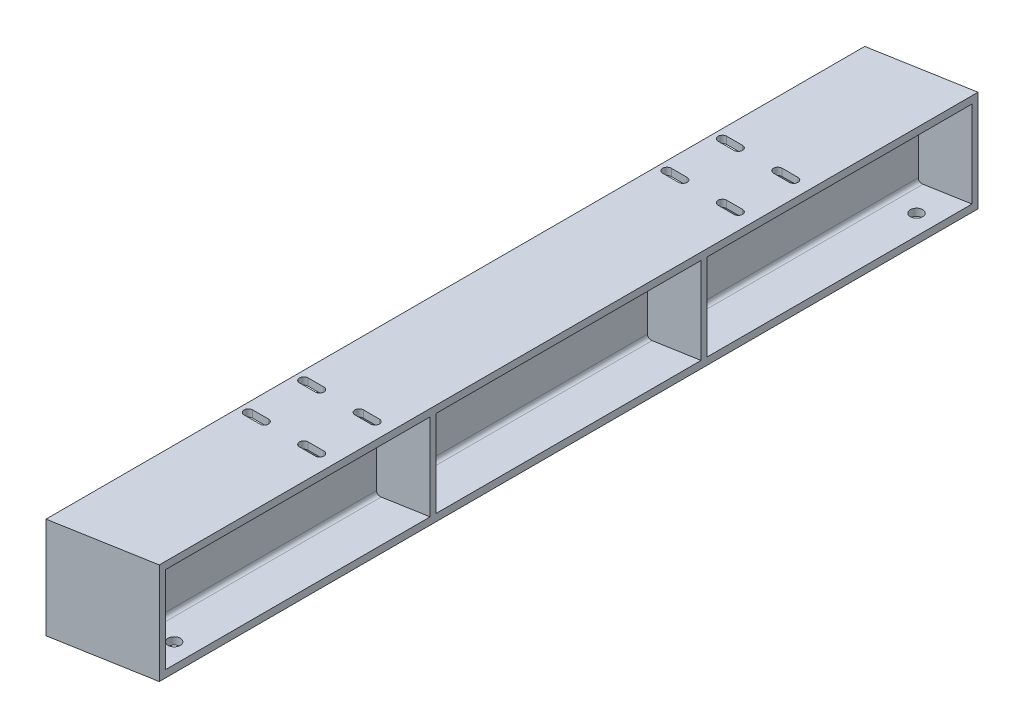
SolidWorks part; units mm, degrees
ref_plane "Plane1" through (0, 0, 0) normal (0, 0, 1) x (1, 0, 0)
ref_plane "Plane2" through (0, 0, 0) normal (0, 1, 0) x (1, 0, 0)
ref_plane "Plane3" through (0, 0, 0) normal (1, 0, 0) x (0, 0, -1)
sketch "Sketch1" plane through (0, 0, 0) normal (0, 0, 1) x (1, 0, 0)
  line L0 (0, 0) -> (0, 11.557)
  line L1 (0, 11.557) -> (66.802, 11.557)
  line L2 (73.152, 17.907) -> (73.152, 144.145)
  line L3 (66.802, 150.495) -> (0, 150.495)
  line L4 (0, 150.495) -> (0, 162.052)
  line L5 (0, 162.052) -> (154.432, 162.052)
  line L6 (154.432, 162.052) -> (154.432, 150.495)
  line L7 (154.432, 150.495) -> (87.63, 150.495)
  line L8 (81.28, 144.145) -> (81.28, 17.907)
  line L9 (87.63, 11.557) -> (154.432, 11.557)
  line L10 (154.432, 11.557) -> (154.432, 0)
  line L11 (154.432, 0) -> (0, 0)
  line L12 (77.216, -72.1361) -> (77.216, 162.052) construction
  arc A0 (66.802, 11.557) -> (73.152, 17.907) centre (66.802, 17.907) ccw
  arc A1 (73.152, 144.145) -> (66.802, 150.495) centre (66.802, 144.145) ccw
  arc A2 (87.63, 150.495) -> (81.28, 144.145) centre (87.63, 144.145) ccw
  arc A3 (81.28, 17.907) -> (87.63, 11.557) centre (87.63, 17.907) ccw
extrude "BaseSteelW" add sketch "Sketch1" against normal mid plane 1340.358
sketch "Sketch2" plane through (0, 162.052, 0) normal (0, 1, 0) x (1, 0, 0)
  line L0 (0, 670.179) -> (154.432, 670.179)
  line L1 (154.432, 670.179) -> (0, 642.9504)
  line L2 (0, 670.179) -> (0, -670.179) construction
  line L3 (0, 642.9504) -> (0, 670.179)
  line L4 (154.432, -670.179) -> (0, -670.179)
  line L5 (154.432, -670.179) -> (154.432, -642.9504)
  line L6 (154.432, 670.179) -> (154.432, -670.179) construction
  line L7 (154.432, -642.9504) -> (0, -670.179)
  dimension "D1" = 80.001
  dimension "D2" = 80.001
extrude "Cut-Extrude1" cut sketch "Sketch2" against normal through all
ref_plane "Plane4" through (77.216, 0, 0) normal (1, 0, 0) x (0, 0, -1)
sketch "Sketch6" plane through (0, 162.052, 0) normal (0, 1, 0) x (1, 0, 0)
  line L0 (0, 642.9504) -> (154.432, 670.179)
  line L1 (154.432, 670.179) -> (154.432, 660.5071)
  line L2 (154.432, 670.179) -> (154.432, -642.9504) construction
  line L3 (154.432, 660.5071) -> (0, 633.2785)
  line L4 (0, 642.9504) -> (0, -670.179) construction
  line L5 (0, 633.2785) -> (0, 642.9504)
  dimension "D1" = 9.525
extrude "Boss-Extrude2" add sketch "Sketch6" against normal up to surface (162.052 mm away)
pattern_linear "LPattern2" count 4 spacing 434.5051 along (0.1736, 0, 0.9848) of "Boss-Extrude2"
hole_wizard "3/4 Clearance Hole1" positions "Sketch4" profile "Sketch3" hole size "3/4" standard "Ansi Inch"
sketch "Sketch4" plane through (0, 11.557, 0) normal (0, 1, 0) x (-1, 0, 0)
  line L0 (0, -633.2785) -> (-66.802, -645.0567) construction
  line L1 (-66.802, 648.7867) -> (0, 660.5649) construction
  line L2 (-87.63, -648.7289) -> (-154.432, -660.5071) construction
  line L3 (-154.432, 633.3363) -> (-87.63, 645.1145) construction
  line L4 (-154.432, 208.5031) -> (-154.432, 633.3363) construction
  line L5 (-154.432, -660.5071) -> (-154.432, -235.6739) construction
  line L6 (0, -633.2785) -> (0, -208.4453) construction
  line L7 (0, 235.7317) -> (0, 660.5649) construction
  point P0 (-31.75, -587.2929)
  point P2 (-31.75, 603.3833)
  point P4 (-122.682, 587.3507)
  point P6 (-122.682, -603.3255)
  dimension "D1" = 50.8
  dimension "D2" = 50.8
  dimension "D3" = 50.8
  dimension "D4" = 50.8
  dimension "D5" = 31.75
  dimension "D6" = 31.75
  dimension "D7" = 31.75
  dimension "D8" = 31.75
sketch "Sketch3" plane through (31.75, 11.557, -587.2929) normal (1, 0, 0) x (0, 0, 1)
  line L0 (0, 0) -> (0, 11.557)
  line L1 (0, 11.557) -> (9.9212, 11.557)
  line L2 (9.9212, 11.557) -> (9.9212, 0)
  line L5 (9.9212, 0) -> (0, 0)
  line L11 (0, -6.35) -> (0, 107.95) construction
  dimension "Thru Hole Dia." = 19.8425
  dimension "Thru Hole Depth" = 11.557
sketch "No Paint Zone, Bottom" plane through (0, 0, 0) normal (0, -1, 0) x (1, 0, 0)
  line L1 (0, -511.3014) -> (154.432, -670.179) construction
  line L3 (0, -642.9504) -> (154.432, -538.5582) construction
  line L4 (0, -511.3014) -> (154.432, -538.5582)
  line L5 (0, -642.9504) -> (0, 670.2368) construction
  line L6 (154.432, -670.179) -> (154.432, 643.0082) construction
  line L7 (0, 537.9694) -> (154.432, 510.7127)
  line L8 (0, 670.2368) -> (154.432, 510.7127) construction
  line L9 (154.432, 643.0082) -> (0, 537.9694) construction
sketch "No Paint Zone, Around Bolt Holes" plane through (0, 11.557, 0) normal (0, 1, 0) x (1, 0, 0)
  circle A0 centre (31.75, 587.2929) radius 19.05
  circle A1 centre (31.75, -603.3833) radius 19.05
  circle A2 centre (122.682, -587.3507) radius 19.05
  circle A3 centre (122.682, 603.3255) radius 19.05
  dimension "D1" = 38.1
sketch "No Paint Zone, Top" plane through (0, 162.052, 0) normal (0, 1, 0) x (1, 0, 0)
  line L1 (27.3305, 258.9253) -> (0, 363.3365)
  line L3 (0, 642.9504) -> (0, -670.2368) construction
  line L5 (0, 363.3365) -> (0, 396.1779)
  line L7 (23.2357, -261.2271) -> (131.1868, -134.228) construction
  line L9 (23.2368, -134.2271) -> (131.1857, -261.228) construction
  line L11 (27.3305, 258.9253) -> (127.1015, 429.4478) construction
  line L12 (0, 396.1779) -> (127.1015, 429.4478)
  line L13 (23.2357, -261.2271) -> (23.2368, -134.2271)
  line L14 (23.2368, -134.2271) -> (131.1868, -134.228)
  line L15 (131.1868, -134.228) -> (131.1857, -261.228)
  line L16 (131.1857, -261.228) -> (23.2357, -261.2271)
  line L17 (0, 396.1779) -> (154.432, 325.0366) construction
  line L22 (127.1015, 429.4478) -> (154.432, 325.0366)
  line L23 (154.432, 670.179) -> (154.432, -643.0082) construction
  line L24 (154.432, 325.0366) -> (154.432, 292.1952)
  line L25 (154.432, 292.1952) -> (27.3305, 258.9253)
ref_point "Point1"
sketch "Sketch7" plane through (0, 162.052, 0) normal (0, 1, 0) x (1, 0, 0)
  line L0 (-3088.7228, -17.4888) -> (-1221.7255, -17.5051) construction
  line L1 (-95.8438, -17.5149) -> (232.2311, -17.5177) construction
  line L2 (39.4436, -359.7058) -> (14.0436, -359.7056) construction
  line L3 (39.4435, -366.6527) -> (14.0435, -366.6525)
  line L4 (39.4436, -352.7589) -> (14.0436, -352.7587)
  line L5 (39.4444, -270.8058) -> (14.0444, -270.8056) construction
  line L6 (39.4443, -277.7527) -> (14.0443, -277.7525)
  line L7 (39.4444, -263.8589) -> (14.0444, -263.8587)
  line L8 (128.3436, -359.7066) -> (102.9436, -359.7063) construction
  line L9 (128.3435, -366.6535) -> (102.9435, -366.6532)
  line L10 (128.3436, -352.7597) -> (102.9436, -352.7594)
  line L11 (128.3444, -270.8066) -> (102.9444, -270.8063) construction
  line L12 (128.3443, -277.7535) -> (102.9443, -277.7532)
  line L13 (128.3444, -263.8597) -> (102.9444, -263.8594)
  line L14 (39.4494, 311.6822) -> (14.0494, 311.6825) construction
  line L15 (39.4494, 304.7353) -> (14.0494, 304.7356)
  line L16 (39.4495, 318.6291) -> (14.0495, 318.6294)
  line L17 (39.4502, 400.5822) -> (14.0502, 400.5825) construction
  line L18 (39.4502, 393.6353) -> (14.0502, 393.6356)
  line L19 (39.4503, 407.5291) -> (14.0503, 407.5294)
  line L20 (128.3494, 311.6815) -> (102.9494, 311.6817) construction
  line L21 (128.3494, 304.7346) -> (102.9494, 304.7348)
  line L22 (128.3495, 318.6284) -> (102.9495, 318.6286)
  line L23 (128.3502, 400.5815) -> (102.9502, 400.5817) construction
  line L24 (128.3502, 393.6346) -> (102.9502, 393.6348)
  line L25 (128.3503, 407.5284) -> (102.9503, 407.5286)
  line L26 (0, 642.9504) -> (0, -670.2368) construction
  line L27 (154.432, 670.179) -> (154.432, -643.0082) construction
  circle A4 centre (115.6436, -359.7065) radius 15.875 construction
  circle A5 centre (26.7436, -359.7057) radius 15.875 construction
  circle A6 centre (115.6444, -270.8065) radius 15.875 construction
  circle A7 centre (26.7444, -270.8057) radius 15.875 construction
  circle A12 centre (115.6494, 311.6816) radius 15.875 construction
  circle A13 centre (26.7494, 311.6824) radius 15.875 construction
  circle A14 centre (115.6502, 400.5816) radius 15.875 construction
  circle A15 centre (26.7502, 400.5824) radius 15.875 construction
  arc A16 (39.4435, -366.6527) -> (39.4436, -352.7589) centre (39.4436, -359.7058) ccw
  arc A17 (14.0436, -352.7587) -> (14.0435, -366.6525) centre (14.0436, -359.7056) ccw
  arc A18 (39.4443, -277.7527) -> (39.4444, -263.8589) centre (39.4444, -270.8058) ccw
  arc A19 (14.0444, -263.8587) -> (14.0443, -277.7525) centre (14.0444, -270.8056) ccw
  arc A20 (128.3435, -366.6535) -> (128.3436, -352.7597) centre (128.3436, -359.7066) ccw
  arc A21 (102.9436, -352.7594) -> (102.9435, -366.6532) centre (102.9436, -359.7063) ccw
  arc A22 (128.3443, -277.7535) -> (128.3444, -263.8597) centre (128.3444, -270.8066) ccw
  arc A23 (102.9444, -263.8594) -> (102.9443, -277.7532) centre (102.9444, -270.8063) ccw
  arc A24 (39.4494, 304.7353) -> (39.4495, 318.6291) centre (39.4494, 311.6822) ccw
  arc A25 (14.0495, 318.6294) -> (14.0494, 304.7356) centre (14.0494, 311.6825) ccw
  arc A26 (39.4502, 393.6353) -> (39.4503, 407.5291) centre (39.4502, 400.5822) ccw
  arc A27 (14.0503, 407.5294) -> (14.0502, 393.6356) centre (14.0502, 400.5825) ccw
  arc A28 (128.3494, 304.7346) -> (128.3495, 318.6284) centre (128.3494, 311.6815) ccw
  arc A29 (102.9495, 318.6286) -> (102.9494, 304.7348) centre (102.9494, 311.6817) ccw
  arc A30 (128.3502, 393.6346) -> (128.3503, 407.5284) centre (128.3502, 400.5815) ccw
  arc A31 (102.9503, 407.5286) -> (102.9502, 393.6348) centre (102.9502, 400.5817) ccw
  point P30 (26.7436, -359.7057)
  point P36 (26.7444, -270.8057)
  point P43 (115.6436, -359.7065)
  point P50 (115.6444, -270.8065)
  point P57 (26.7494, 311.6824)
  point P64 (26.7502, 400.5824)
  point P71 (115.6494, 311.6816)
  point P78 (115.6502, 400.5816)
  dimension "D1" = 13.8938
  dimension "D2" = 25.4
  dimension "D3" = 270.8054
  dimension "D4" = 88.9
  dimension "D5" = 270.8054
  dimension "D6" = 88.9
  dimension "D7" = 14.0444
  dimension "D8" = 14.0436
  dimension "D9" = 26.0884
  dimension "D10" = 26.0876
  dimension "D11" = 311.6826
  dimension "D12" = 88.9
  dimension "D13" = 311.6826
  dimension "D14" = 88.9
  dimension "D15" = 14.0494
  dimension "D16" = 14.0502
  dimension "D17" = 26.0818
  dimension "D18" = 26.0826
extrude "Cut-Extrude2" cut sketch "Sketch7" against normal up to surface (11.557 mm away)
equation "\"D1@Sketch1\" = \"Tw@Sketch1\" / 2"
equation "\"D2@Sketch1\" = \"Tf@Sketch1\""
